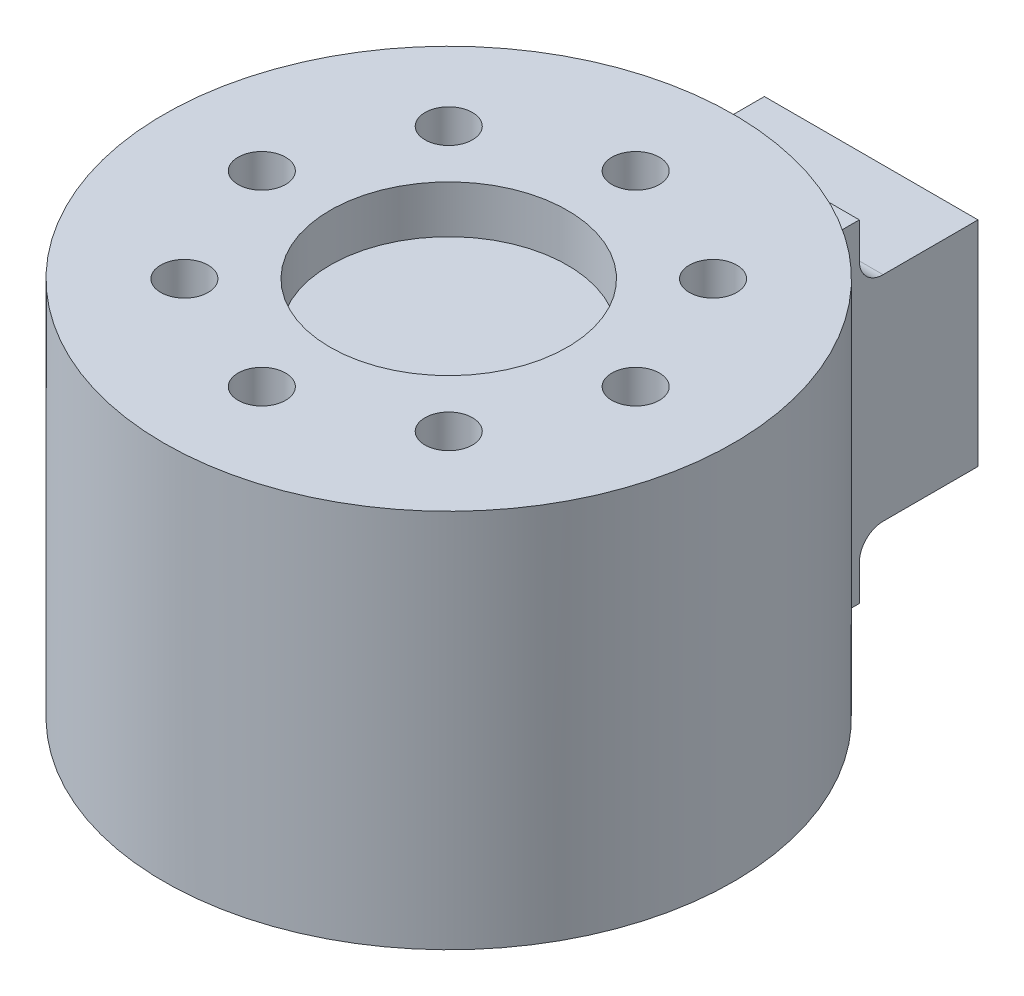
SolidWorks part; units mm, degrees
ref_plane "Front Plane" through (0, 0, 0) normal (0, 0, 1) x (1, 0, 0)
ref_plane "Top Plane" through (0, 0, 0) normal (0, 1, 0) x (1, 0, 0)
ref_plane "Right Plane" through (0, 0, 0) normal (1, 0, 0) x (0, 0, -1)
sketch "Sketch1" plane through (0, 0, 0) normal (0, 1, 0) x (1, 0, 0)
  circle A0 centre (0, 0) radius 24
  dimension "D1" = 48
extrude "Boss-Extrude1" add sketch "Sketch1" along normal blind 32
sketch "Sketch2" plane through (0, 32, 0) normal (0, 1, 0) x (1, 0, 0)
  circle A0 centre (0, 0) radius 10
  dimension "D1" = 20
extrude "Cut-Extrude1" cut sketch "Sketch2" against normal blind 4
sketch "Sketch3" plane through (0, 0, 0) normal (0, 0, 1) x (1, 0, 0)
  line L0 (0, 0) -> (0, 32) construction
  line L1 (24, 32) -> (-24, 32) construction
  line L2 (-24, 0) -> (24, 0) construction
  line L3 (-9, 28) -> (9, 28)
  line L4 (-9, 28) -> (-9, 0)
  line L5 (-9, 0) -> (9, 0)
  line L6 (9, 28) -> (9, 0)
  line L7 (-9, 28) -> (9, 0) construction
  line L8 (-9, 0) -> (9, 28) construction
  point P5 (0, 14)
  dimension "D1" = 18
  dimension "D2" = 28
extrude "Boss-Extrude2" add sketch "Sketch3" against normal blind 35.6
sketch "Sketch4" plane through (0, 0, 0) normal (0, -1, 0) x (1, 0, 0)
  line L0 (0, 0) -> (22, 0) construction
  circle A0 centre (0, 0) radius 22 construction
  circle A1 centre (22, 0) radius 1.5
  dimension "D1" = 44
  dimension "D2" = 3
extrude "Cut-Extrude2" cut sketch "Sketch4" against normal blind 4
sketch "Sketch6" plane through (0, 32, 0) normal (0, 1, 0) x (1, 0, 0)
  line L0 (0, 0) -> (0, -26.5326) construction
  circle A0 centre (0, 0) radius 15.75 construction
  circle A1 centre (0, -15.75) radius 2
  dimension "D1" = 31.5
  dimension "D2" = 4
extrude "Cut-Extrude4" cut sketch "Sketch6" against normal blind 4
pattern_circular "CirPattern1" count 8 over 360 about axis through (0, 0, 0) along (0, 1, 0) of "Cut-Extrude2", "Cut-Extrude4"
sketch "Sketch5" plane through (9, 0, 0) normal (1, 0, 0) x (0, 0, -1)
  line L0 (35.6, 14) -> (-0.5625, 14) construction
  line L2 (35.6, 0) -> (35.6, 28) construction
  line L5 (35.6, 28) -> (25.6, 28)
  line L6 (35.6, 28) -> (35.6, 23)
  line L7 (35.6, 23) -> (25.6, 23)
  line L8 (25.6, 28) -> (25.6, 23)
  line L9 (35.6, 0) -> (25.6, 0)
  line L10 (35.6, 0) -> (35.6, 5)
  line L11 (35.6, 5) -> (25.6, 5)
  line L12 (25.6, 0) -> (25.6, 5)
  dimension "D1" = 5
  dimension "D2" = 5
  dimension "D3" = 10
extrude "Cut-Extrude3" cut sketch "Sketch5" against normal through all
fillet "Fillet1" radius 2 2 edges at (0, 5, -25.6) (0, 23, -25.6)
sketch "Sketch7" plane through (0, 0, 0) normal (0, -1, 0) x (1, 0, 0)
  line L3 (-9, -22.2486) -> (-9, -25.6)
  line L4 (-9, -25.6) -> (9, -25.6)
  line L5 (9, -25.6) -> (9, -22.2486)
  line L6 (-9, -22.2486) -> (-9, -25.6)
  line L7 (-9, -25.6) -> (9, -25.6)
  line L8 (9, -25.6) -> (9, -22.2486)
  circle A1 centre (0, 22) radius 1.5
  circle A2 centre (0, 22) radius 1.5
  circle A3 centre (22, 0) radius 1.5
  circle A4 centre (22, 0) radius 1.5
  circle A5 centre (15.5563, 15.5563) radius 1.5
  circle A6 centre (15.5563, 15.5563) radius 1.5
  circle A7 centre (-15.5563, -15.5563) radius 1.5
  circle A8 centre (-15.5563, -15.5563) radius 1.5
  circle A9 centre (0, -22) radius 1.5
  circle A10 centre (0, -22) radius 1.5
  circle A11 centre (15.5563, -15.5563) radius 1.5
  circle A12 centre (15.5563, -15.5563) radius 1.5
  circle A13 centre (-22, 0) radius 1.5
  circle A14 centre (-22, 0) radius 1.5
  circle A15 centre (-15.5563, 15.5563) radius 1.5
  circle A16 centre (-15.5563, 15.5563) radius 1.5
  arc A17 (9, -22.2486) -> (-9, -22.2486) centre (0, 0) ccw
  arc A18 (9, -22.2486) -> (-9, -22.2486) centre (0, 0) ccw
  dimension "D1" = 0
  dimension "D2" = 0
  dimension "D3" = 0
  dimension "D4" = 0
  dimension "D5" = 0
  dimension "D6" = 0
  dimension "D7" = 0
  dimension "D8" = 0
  dimension "D9" = 0
sketch "Sketch8" plane through (0, 32, 0) normal (0, 1, 0) x (1, 0, 0)
  circle A0 centre (-15.75, 0) radius 2 construction
  circle A1 centre (0, 0) radius 24
  circle A2 centre (0, 0) radius 24
  circle A3 centre (-11.1369, 11.1369) radius 2 construction
  circle A4 centre (0, 15.75) radius 2 construction
  circle A5 centre (11.1369, 11.1369) radius 2 construction
  circle A6 centre (15.75, 0) radius 2 construction
  circle A7 centre (11.1369, -11.1369) radius 2 construction
  circle A8 centre (0, -15.75) radius 2 construction
  circle A9 centre (-11.1369, -11.1369) radius 2 construction
  circle A10 centre (-11.1369, -11.1369) radius 2
  circle A11 centre (0, 0) radius 10
  circle A12 centre (0, 0) radius 10
  circle A13 centre (0, -15.75) radius 2
  circle A14 centre (11.1369, -11.1369) radius 2
  circle A15 centre (15.75, 0) radius 2
  circle A16 centre (11.1369, 11.1369) radius 2
  circle A17 centre (0, 15.75) radius 2
  circle A18 centre (-11.1369, 11.1369) radius 2
  circle A19 centre (-15.75, 0) radius 2
  dimension "D1" = 0
  dimension "D2" = 0
